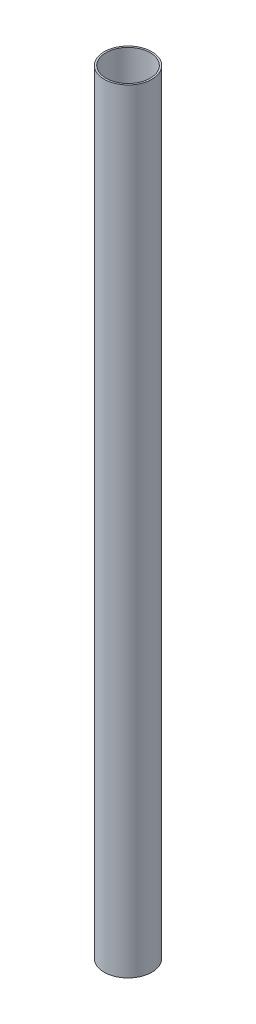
SolidWorks part; units mm, degrees
ref_plane "Front Plane" through (0, 0, 0) normal (0, 0, 1) x (1, 0, 0)
ref_plane "Top Plane" through (0, 0, 0) normal (0, 1, 0) x (1, 0, 0)
ref_plane "Right Plane" through (0, 0, 0) normal (1, 0, 0) x (0, 0, -1)
sketch "Sketch1" plane through (0, 0, 0) normal (0, 1, 0) x (1, 0, 0)
  circle A0 centre (0, 0) radius 17.4625
  circle A1 centre (0, 0) radius 18.8087
  dimension "D1" = 37.6174
  dimension "D2" = 34.925
extrude "Boss-Extrude1" add sketch "Sketch1" along normal blind 609.6
